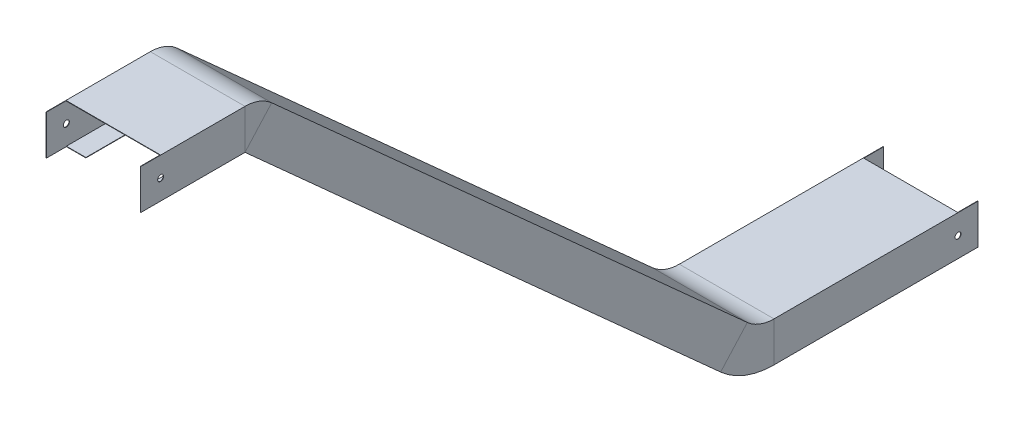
SolidWorks part; units mm, degrees
ref_plane "Front Plane" through (0, 0, 0) normal (0, 0, 1) x (1, 0, 0)
ref_plane "Top Plane" through (0, 0, 0) normal (0, 1, 0) x (1, 0, 0)
ref_plane "Right Plane" through (0, 0, 0) normal (1, 0, 0) x (0, 0, -1)
sketch "Sketch1" plane through (0, 0, 0) normal (1, 0, 0) x (0, 0, -1)
  line L0 (-5475.7282, 0) -> (6538.835, 0) construction
  line L1 (4000, -2250) -> (2153.4944, -2250)
  line L5 (4000, -2250) -> (-4000, 2250) construction
  line L6 (4000, 2250) -> (-4000, -2250) construction
  line L7 (-3000, 3123.7864) -> (-3000, -3269.4175) construction
  line L8 (2000, 3123.7864) -> (2000, -3822.8155) construction
  line L9 (-2885.9085, 2147.3177) -> (1885.9085, -2147.3177)
  line L11 (-3153.4944, 2250) -> (-4000, 2250)
  arc A0 (1885.9085, -2147.3177) -> (2153.4944, -2250) centre (2153.4944, -1850) ccw
  arc A1 (-2885.9085, 2147.3177) -> (-3153.4944, 2250) centre (-3153.4944, 1850) ccw
  point P0 (0, 0)
  point P16 (2000, -2250)
  point P19 (-3000, 2250)
  dimension "D6" = 400
  dimension "D1" = 4500
  dimension "D2" = 4500
  dimension "D3" = 8000
  dimension "D4" = 2000
  dimension "D5" = 1000
ref_plane "Plane1" through (0, 0, -4000) normal (0, 0, 1) x (1, 0, 0)
sketch "Sketch5" plane through (0, 0, -4000) normal (0, 0, 1) x (1, 0, 0)
  line L0 (-1364.6712, -2250) -> (2549.4676, -2250) construction
  line L1 (-475, -2250) -> (475, -2250)
  line L2 (0, 3123.7864) -> (0, -3269.4175) construction
  line L3 (-475, -2250) -> (-475, -2650)
  line L4 (475, -2250) -> (475, -2650)
  line L5 (-475, -2650) -> (-275, -2650)
  line L6 (-471, -2254) -> (471, -2254)
  line L7 (471, -2254) -> (471, -2646)
  line L8 (-471, -2646) -> (-275, -2646)
  line L9 (-471, -2254) -> (-471, -2646)
  line L10 (-275, -2476.4292) -> (-275, -2922.6524) construction
  line L11 (-275, -2650) -> (-275, -2646)
  line L12 (275, -2922.6524) -> (275, -2476.4292) construction
  line L13 (275, -2650) -> (275, -2646)
  line L14 (275, -2650) -> (475, -2650)
  line L15 (-475, -2650) -> (475, -2650) construction
  line L16 (275, -2646) -> (471, -2646)
  line L17 (-471, -2646) -> (471, -2646) construction
  dimension "D1" = 950
  dimension "D2" = 475
  dimension "D3" = 4
  dimension "D4" = 400
  dimension "D5" = 200
  dimension "D6" = 200
sweep "Sweep1" add profiles "Sketch5" path "Sketch1"
sketch "Sketch6" plane through (0, 0, 0) normal (1, 0, 0) x (0, 0, -1)
  line L0 (-4000, 2250) -> (-4000, 1850) construction
  line L1 (2153.4944, -2450) -> (3800, -2450) construction
  line L2 (2153.4944, -2650) -> (2153.4944, -2250) construction
  line L3 (4000, 522.5) -> (4000, -522.5) construction
  line L4 (4000, -2650) -> (4000, -2250) construction
  line L5 (-4000, 2250) -> (-3153.4944, 2250)
  line L6 (4000, -2250) -> (2153.4944, -2250)
  line L7 (1885.9085, -2147.3177) -> (-2885.9085, 2147.3177)
  line L8 (-4000, 1850) -> (-3153.4944, 1850)
  line L9 (-3153.4944, 1850) -> (1618.3226, -2444.6353)
  line L10 (2153.4944, -2650) -> (4000, -2650)
  arc A0 (-4000, 2250) -> (-4000, 1850) centre (-4000, 2050) ccw
  arc A1 (4000, -2650) -> (4000, -2250) centre (4000, -2450) ccw
  arc A2 (1885.9085, -2147.3177) -> (2153.4944, -2250) centre (2153.4944, -1850) ccw
  arc A3 (-3153.4944, 2250) -> (-2885.9085, 2147.3177) centre (-3153.4944, 1850) cw
  arc A5 (1618.3226, -2444.6353) -> (2153.4944, -2650) centre (2153.4944, -1850) ccw
  dimension "D1" = 400
sketch "Sketch7" plane through (475, 0, 0) normal (1, 0, 0) x (0, 0, -1)
  line L0 (-4000, 2250) -> (-4000, 1850) construction
  line L1 (-4000, 2250) -> (-4200, 2250)
  line L3 (-4000, 1850) -> (-4200, 1850)
  line L4 (-4200, 2250) -> (-4200, 1850)
  line L5 (-4000, 2050) -> (-4200, 1850) construction
  line L6 (-4000, 2050) -> (-4200, 2250) construction
  line L7 (-4000, 2250) -> (-4000, 1850)
  point P0 (-4000, 2050)
extrude "Boss-Extrude1" add sketch "Sketch7" against normal blind 4
mirror "Mirror1" about plane through (0, 0, 0) normal (1, 0, 0) of "Boss-Extrude1"
sketch "Sketch8" plane through (475, 0, 0) normal (1, 0, 0) x (0, 0, -1)
  circle A0 centre (-4000, 2050) radius 30
extrude "Cut-Extrude1" cut sketch "Sketch8" against normal blind 4
mirror "Mirror2" about plane through (0, 0, 0) normal (1, 0, 0) of "Cut-Extrude1"
sketch "Sketch9" plane through (475, 0, 0) normal (1, 0, 0) x (0, 0, -1)
  line L0 (4000, -2250) -> (4000, -2650)
  line L1 (4000, -2650) -> (4200, -2650)
  line L3 (4000, -2250) -> (4200, -2250)
  line L4 (4200, -2650) -> (4200, -2250)
  line L5 (4000, -2450) -> (4200, -2250) construction
  line L6 (4000, -2450) -> (4200, -2650) construction
  point P0 (4000, -2450)
extrude "Boss-Extrude2" add sketch "Sketch9" against normal blind 4
mirror "Mirror3" about plane through (0, 0, 0) normal (1, 0, 0) of "Boss-Extrude2"
sketch "Sketch11" plane through (475, 0, 0) normal (1, 0, 0) x (0, 0, -1)
  circle A0 centre (4000, -2450) radius 30
extrude "Cut-Extrude2" cut sketch "Sketch11" against normal blind 4
mirror "Mirror4" about plane through (0, 0, 0) normal (1, 0, 0) of "Cut-Extrude2"
